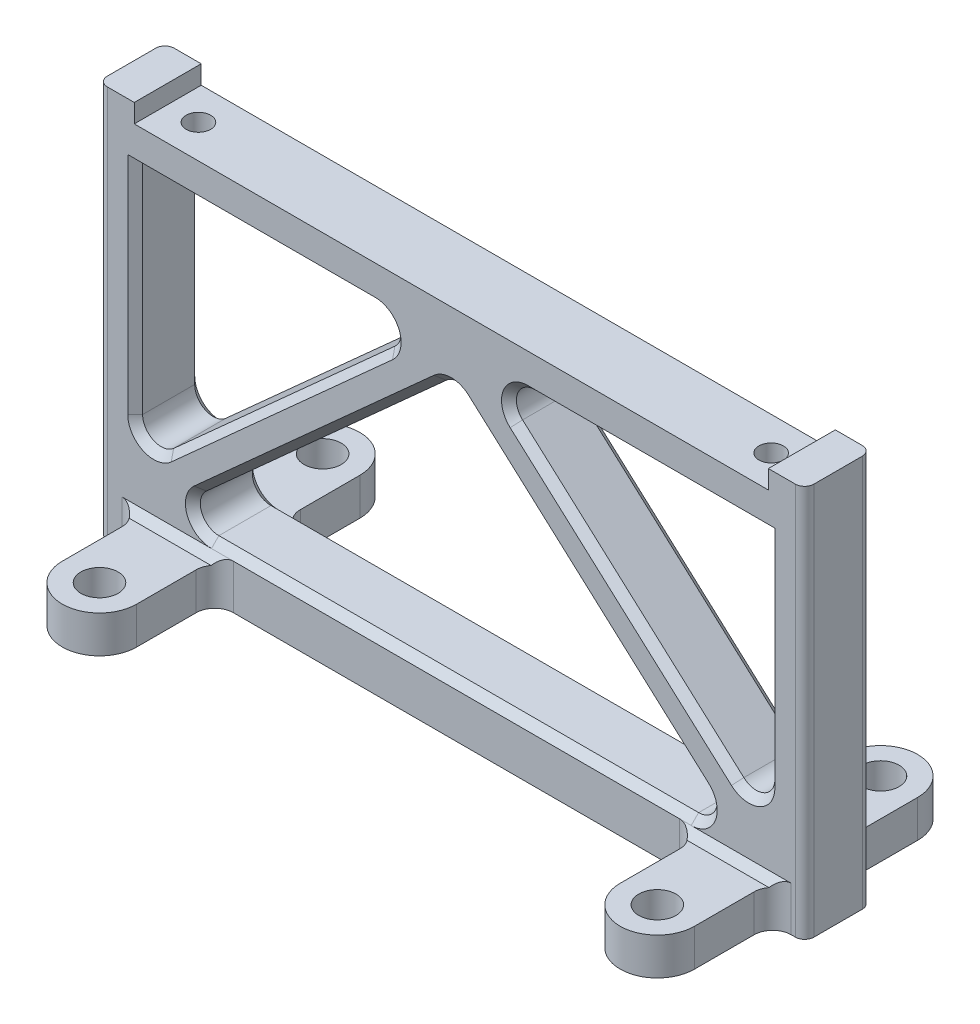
SolidWorks part; units mm, degrees
ref_plane "Ebene vorne" through (0, 0, 0) normal (0, 0, 1) x (1, 0, 0)
ref_plane "Ebene oben" through (0, 0, 0) normal (0, 1, 0) x (1, 0, 0)
ref_plane "Ebene rechts" through (0, 0, 0) normal (1, 0, 0) x (0, 0, -1)
sketch "Skizze1" plane through (0, 0, 0) normal (0, 0, 1) x (1, 0, 0)
  line L0 (0, 0) -> (0, -100.5) construction
  line L1 (-85, 0) -> (85, 0)
  line L2 (85, 0) -> (85, 5)
  line L3 (85, 5) -> (95, 5)
  line L4 (95, 5) -> (95, -100.5)
  line L5 (95, -100.5) -> (-95, -100.5)
  line L6 (-95, 5) -> (-95, -100.5)
  line L7 (-85, 5) -> (-95, 5)
  line L8 (-85, 0) -> (-85, 5)
  line L10 (-85, -10) -> (85, -10)
  line L11 (-85, -10) -> (-85, -86.5)
  line L12 (-85, -86.5) -> (85, -86.5)
  line L13 (85, -10) -> (85, -86.5)
  dimension "D1" = 170
  dimension "D2" = 100.5
  dimension "D3" = 5
  dimension "D4" = 10
  dimension "D5" = 10
  dimension "D6" = 14
extrude "Aufsatz-Linear austragen1" add sketch "Skizze1" along normal blind 18
hole_wizard "Ø6.6 (6.6) Durchmesser Bohrung1" positions "Skizze2" profile "Skizze3" hole size "Ø6.6" standard "DIN"
sketch "Skizze2" plane through (0, 0, 0) normal (0, 1, 0) x (1, 0, 0)
  line L0 (0, 0) -> (0, -18) construction
  line L1 (85, 0) -> (-85, 0) construction
  line L2 (85, -18) -> (-85, -18) construction
  line L5 (0, -9) -> (-77, -9) construction
  line L7 (-85, -18) -> (-85, 0) construction
  point P0 (-77, -9)
  point P18 (77, -9)
  dimension "D1" = 8
sketch "Skizze3" plane through (-77, 0, 9) normal (1, 0, 0) x (0, 0, 1)
  line L0 (0, 0) -> (0, 10)
  line L1 (0, 10) -> (3.3, 10)
  line L2 (3.3, 10) -> (3.3, 0)
  line L5 (3.3, 0) -> (0, 0)
  line L11 (0, -6.35) -> (0, 107.95) construction
  dimension "Bohrerdurchmesser" = 6.6
  dimension "Bohrungstiefe" = 10
sketch "Skizze4" plane through (0, 0, 18) normal (0, 0, 1) x (1, 0, 0)
  line L0 (-85, -86.5) -> (0, -10)
  line L1 (85, -10) -> (-85, -10) construction
  line L2 (0, -10) -> (85, -86.5)
extrude "Linear-Austragen-Dünn1" add sketch "Skizze4" against normal up to surface (18 mm away) thin
sketch "Skizze5" plane through (0, -100.5, 0) normal (0, -1, 0) x (1, 0, 0)
  line L0 (95, 9) -> (-95, 9) construction
  line L1 (95, 18) -> (95, 0) construction
  line L2 (-95, 18) -> (-95, 0) construction
  line L3 (76.4, 9) -> (76.4, -21) construction
  line L4 (-63.6, 18) -> (-63.6, 39)
  line L5 (-83.6, 18) -> (-83.6, 39)
  line L6 (86.4, 0) -> (86.4, -21)
  line L7 (-95, 0) -> (95, 0) construction
  line L8 (86.4, -21) -> (76.4, -21) construction
  line L9 (76.4, -21) -> (76.4, -36) construction
  line L10 (86.4, 0) -> (66.4, 0)
  line L11 (66.4, 0) -> (66.4, -21)
  line L12 (-63.6, 0) -> (-83.6, 0)
  line L13 (-83.6, 0) -> (-83.6, -21)
  line L14 (-63.6, 0) -> (-63.6, -21)
  line L15 (-63.6, 18) -> (-83.6, 18)
  line L16 (86.4, 18) -> (86.4, 39)
  line L17 (66.4, 18) -> (66.4, 39)
  line L18 (86.4, 18) -> (66.4, 18)
  circle A0 centre (76.4, -21) radius 5
  arc A1 (86.4, -21) -> (66.4, -21) centre (76.4, -21) cw
  arc A2 (-63.6, -21) -> (-83.6, -21) centre (-73.6, -21) cw
  circle A3 centre (-73.6, -21) radius 5
  circle A4 centre (-73.6, 39) radius 5
  arc A5 (-63.6, 39) -> (-83.6, 39) centre (-73.6, 39) ccw
  circle A6 centre (76.4, 39) radius 5
  arc A7 (86.4, 39) -> (66.4, 39) centre (76.4, 39) ccw
  point P19 (76.4, 0)
  dimension "D3" = 10
  dimension "D1" = 30
  dimension "D2" = 18.6
  dimension "D4" = 20
  dimension "D6" = 150
  dimension "D5" = 2
extrude "Aufsatz-Linear austragen2" add sketch "Skizze5" against normal blind 10
fillet "Verrundung1" radius 5 7 edges at (-77.5258, -86.5, 9) (0, -16.7268, 9) (7.4742, -10, 9) (-7.4742, -10, 9) (85, -79.7732, 9) (77.5258, -86.5, 9) (-85, -79.7732, 9)
fillet "Verrundung2" radius 2.5 4 edges at (-95, -47.75, 0) (-95, -47.75, 18) (95, -47.75, 0) (95, -47.75, 18)
fillet "Verrundung3" radius 5 8 edges at (86.4, -95.5, 18) (86.4, -95.5, 0) (66.4, -95.5, 18) (66.4, -95.5, 0) (-63.6, -95.5, 18) (-83.6, -95.5, 18) (-83.6, -95.5, 0) (-63.6, -95.5, 0)
chamfer "Fase2" distance 2 angle 45 4 edges at (76.4, -90.5, 18) (76.4, -90.5, 0) (-73.6, -90.5, 18) (-73.6, -90.5, 0)
chamfer "Fase1" distance 2 angle 45 32 edges at (-46.9072, -45.4897, 18) (-46.9072, -45.4897, 0) (-35.5928, -48.7603, 18) (-35.5928, -48.7603, 0) (0, -86.5, 0) (0, -86.5, 18) (35.5928, -48.7603, 0) (35.5928, -48.7603, 18) (46.9072, -45.4897, 0) (46.9072, -45.4897, 18) (-52.752, -10, 0) (-52.752, -10, 18) (85, -39.2732, 0) (85, -39.2732, 18) (-82.0342, -73.1139, 0) (-82.0342, -73.1139, 18) (-69.1641, -83.2913, 0) (-69.1641, -83.2913, 18) (0, -18.4536, 18) (0, -18.4536, 0) (15.8359, -13.2087, 0) (15.8359, -13.2087, 18) (-15.8359, -13.2087, 18) (-15.8359, -13.2087, 0) (82.0342, -73.1139, 18) (82.0342, -73.1139, 0) (69.1641, -83.2913, 18) (69.1641, -83.2913, 0) (-85, -39.2732, 0) (52.752, -10, 0) (-85, -39.2732, 18) (52.752, -10, 18)
other "Fläche verschieben1" parameters "D1"=0.25
other "Fläche verschieben2" parameters "D1"=0.25
